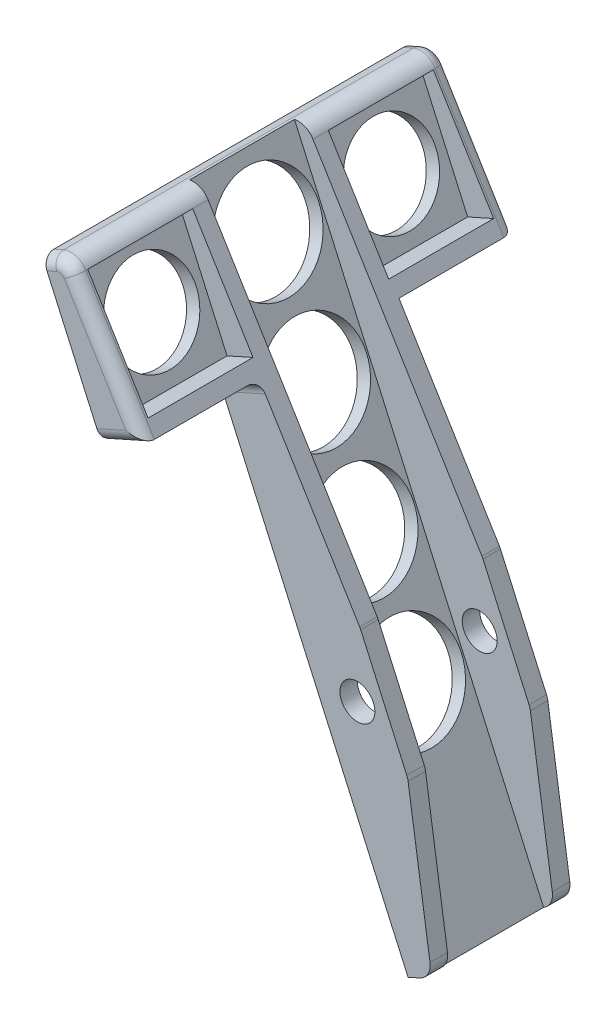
SolidWorks part; units mm, degrees
ref_plane "Plan de face" through (0, 0, 0) normal (0, 0, 1) x (1, 0, 0)
ref_plane "Plan de dessus" through (0, 0, 0) normal (0, 1, 0) x (1, 0, 0)
ref_plane "Plan de droite" through (0, 0, 0) normal (1, 0, 0) x (0, 0, -1)
sketch "Esquisse1" plane through (0, 0, -3) normal (0, 0, 1) x (1, 0, 0)
  line L2 (8.6953, -5.9096) -> (-34.1189, 89.965)
  line L3 (-34.1189, 89.965) -> (-23.1618, 94.8581)
  line L4 (-23.1618, 94.8581) -> (19.6524, -1.0166)
  line L5 (19.6524, -1.0166) -> (8.6953, -5.9096)
  circle A0 centre (0, 30.729) radius 3
  dimension "D1" = 6
  dimension "D2" = 105
  dimension "D3" = 12
  dimension "D4" = 5
  dimension "D7" = 68
extrude "Boss.-Extru.1" add sketch "Esquisse1" against normal blind 3
sketch "Esquisse3" plane through (0, 0, -6) normal (0, 0, -1) x (-1, 0, 0)
  line L0 (34.1189, 89.965) -> (-8.6953, -5.9096)
  line L1 (-8.6953, -5.9096) -> (-10.978, -4.8902)
  line L2 (-8.6953, -5.9096) -> (-19.6524, -1.0166) construction
  line L3 (-10.978, -4.8902) -> (31.8362, 90.9844)
  line L4 (23.1618, 94.8581) -> (34.1189, 89.965) construction
  line L5 (31.8362, 90.9844) -> (34.1189, 89.965)
  dimension "D1" = 2.5
extrude "Boss.-Extru.2" add sketch "Esquisse3" along normal blind 18
sketch "Esquisse4" plane through (0, 0, -24) normal (0, 0, -1) x (-1, 0, 0)
  line L4 (-19.6524, -1.0166) -> (-8.6953, -5.9096)
  line L5 (23.1618, 94.8581) -> (-19.6524, -1.0166)
  line L6 (34.1189, 89.965) -> (23.1618, 94.8581)
  line L7 (-8.6953, -5.9096) -> (34.1189, 89.965)
  line L8 (-19.6524, -1.0166) -> (-8.6953, -5.9096)
  line L9 (23.1618, 94.8581) -> (-19.6524, -1.0166)
  line L10 (34.1189, 89.965) -> (23.1618, 94.8581)
  line L11 (-8.6953, -5.9096) -> (34.1189, 89.965)
  circle A0 centre (0, 30.729) radius 3 construction
  circle A1 centre (0, 30.729) radius 3
  dimension "D1" = 0
extrude "Boss.-Extru.3" add sketch "Esquisse4" along normal blind 3
sketch "Esquisse5" plane through (0, 0, -3) normal (0, 0, 1) x (1, 0, 0)
  line L0 (19.6524, -1.0166) -> (-23.1618, 94.8581) construction
  line L1 (-8.1628, 61.2705) -> (-17.7035, 82.6351)
  arc A0 (-8.1628, 61.2705) -> (-17.7035, 82.6351) centre (-12.6754, 72.0679) ccw
sketch "Esquisse6" plane through (0, 0, -24) normal (0, 0, 1) x (1, 0, 0)
  line L1 (-17.7035, 82.6351) -> (-8.1628, 61.2705)
  line L2 (-17.7035, 82.6351) -> (-8.1628, 61.2705)
  arc A1 (-8.1628, 61.2705) -> (-17.7035, 82.6351) centre (-12.6754, 72.0679) ccw
  arc A2 (-8.1628, 61.2705) -> (-17.7035, 82.6351) centre (-12.6754, 72.0679) ccw
  dimension "D1" = 0
fillet "Congé1" radius 3 2 edges at (19.6524, -1.0166, -25.5) (19.6524, -1.0166, -4.5)
sketch "Esquisse7" plane through (5.0493, 2.2548, 0) normal (-0.9131, -0.4078, 0) x (0, 0, 1)
  line L0 (-15, 96.0584) -> (-15, 69.5886) construction
  line L1 (-45, 96.0584) -> (15, 96.0584)
  line L2 (-45, 96.0584) -> (-45, 76.0584)
  line L3 (-45, 76.0584) -> (15, 76.0584)
  line L4 (15, 96.0584) -> (15, 76.0584)
  line L5 (-27, -8.9416) -> (-27, 96.0584) construction
  line L6 (-3, 96.0584) -> (-3, -8.9416) construction
  dimension "D1" = 60
  dimension "D2" = 20
fillet "Congé2" radius 3 2 edges at (-23.1618, 94.8581, -25.5) (-23.1618, 94.8581, -4.5)
sketch "Esquisse9" plane through (0, 0, -3) normal (0, 0, 1) x (1, 0, 0)
  line L0 (0.4879, 41.8987) -> (-30.01, 91.7999)
  line L1 (18.4291, 1.7227) -> (-21.9386, 92.1188) construction
  line L2 (-25.9011, 93.6348) -> (-34.1189, 89.965) construction
  line L3 (8.643, 23.6369) -> (12.8042, -4.0747)
  line L4 (8.6953, -5.9096) -> (16.9131, -2.2398) construction
  line L5 (0, 30.729) -> (4.5655, 32.7678) construction
  line L6 (-25.9011, 93.6348) -> (-30.01, 91.7999)
  line L7 (18.4291, 1.7227) -> (8.643, 23.6369)
  line L8 (12.8042, -4.0747) -> (16.9131, -2.2398)
  line L9 (0.4879, 41.8987) -> (-21.9386, 92.1188)
  arc A0 (-21.9386, 92.1188) -> (-25.9011, 93.6348) centre (-24.6778, 90.8955) ccw construction
  arc A1 (16.9131, -2.2398) -> (18.4291, 1.7227) centre (15.6898, 0.4994) ccw construction
  arc A2 (-21.9386, 92.1188) -> (-25.9011, 93.6348) centre (-24.6778, 90.8955) ccw
  arc A3 (16.9131, -2.2398) -> (18.4291, 1.7227) centre (15.6898, 0.4994) ccw
  dimension "D1" = 20
extrude "Enlèv. mat.-Extru.2" cut sketch "Esquisse9" against normal through all
fillet "Congé3" radius 3 6 edges at (-30.01, 91.7999, -25.5) (0.4879, 41.8987, -4.5) (0.4879, 41.8987, -25.5) (8.643, 23.6369, -4.5) (8.643, 23.6369, -25.5) (12.8042, -4.0747, -25.5)
sketch "Esquisse11" plane through (0, 0, -3) normal (0, 0, 1) x (1, 0, 0)
  line L0 (-23.9251, 67.1377) -> (-16.8644, 70.2908)
  line L6 (0.3872, 42.0635) -> (-28.6348, 89.5498)
  line L7 (-32.4179, 90.7246) -> (-34.1189, 89.965)
  line L8 (-34.1189, 89.965) -> (8.6953, -5.9096)
  line L9 (8.6953, -5.9096) -> (10.7221, -5.0045)
  line L10 (12.4656, -1.8198) -> (8.7037, 23.2325)
  line L11 (8.4763, 24.0103) -> (0.5667, 41.7224)
  line L12 (-16.8644, 70.2908) -> (-28.6348, 89.5498)
  line L13 (-32.4179, 90.7246) -> (-34.1189, 89.965)
  line L14 (-34.1189, 89.965) -> (-23.9251, 67.1377)
  arc A4 (-28.6348, 89.5498) -> (-32.4179, 90.7246) centre (-31.1946, 87.9854) ccw
  arc A5 (10.7221, -5.0045) -> (12.4656, -1.8198) centre (9.4988, -2.2652) ccw
  arc A6 (8.7037, 23.2325) -> (8.4763, 24.0103) centre (5.737, 22.787) ccw
  arc A7 (0.5667, 41.7224) -> (0.3872, 42.0635) centre (-2.1726, 40.4991) ccw
  arc A8 (-28.6348, 89.5498) -> (-32.4179, 90.7246) centre (-31.1946, 87.9854) ccw
  dimension "D2" = 25
  dimension "D1" = 0
extrude "Boss.-Extru.4" add sketch "Esquisse11" along normal blind 20
sketch "Esquisse12" plane through (0, 0, -27) normal (0, 0, -1) x (-1, 0, 0)
  line L4 (34.1189, 89.965) -> (32.4179, 90.7246)
  line L5 (23.9251, 67.1377) -> (34.1189, 89.965)
  line L6 (16.8644, 70.2908) -> (23.9251, 67.1377)
  line L7 (28.6348, 89.5498) -> (16.8644, 70.2908)
  line L8 (34.1189, 89.965) -> (32.4179, 90.7246)
  line L9 (23.9251, 67.1377) -> (34.1189, 89.965)
  line L10 (16.8644, 70.2908) -> (23.9251, 67.1377)
  line L11 (28.6348, 89.5498) -> (16.8644, 70.2908)
  arc A1 (32.4179, 90.7246) -> (28.6348, 89.5498) centre (31.1946, 87.9854) ccw
  arc A2 (32.4179, 90.7246) -> (28.6348, 89.5498) centre (31.1946, 87.9854) ccw
  dimension "D1" = 0
extrude "Boss.-Extru.5" add sketch "Esquisse12" along normal blind 20
fillet "Congé4" radius 2 9 edges at (-22.7496, 79.9203, -47) (-30.3049, 90.8504, -47) (-22.7496, 79.9203, 17) (-30.3049, 90.8504, 17) (-20.3947, 68.7142, -47) (-33.2684, 90.3448, -47) (-33.2684, 90.3448, 17) (-20.3947, 68.7142, 17)
sketch "Esquisse10" plane through (5.0493, 2.2548, 0) normal (-0.9131, -0.4078, 0) x (0, 0, 1)
  line L0 (-15, 96.0584) -> (-15, 69.5886) construction
  line L1 (-15, 96.0584) -> (-15, 66.8288) construction
  line L2 (-45, 96.0584) -> (15, 96.0584) construction
  circle A0 centre (-15, 85.0404) radius 8.7511
  circle A1 centre (-15, 65.0404) radius 8.7511
  circle A2 centre (-15, 45.0404) radius 8.7511
  circle A3 centre (-15, 25.0404) radius 8.7511
  circle A4 centre (-35.585, 83.5584) radius 7.6574
  circle A5 centre (5.585, 83.5584) radius 7.6574
  dimension "D1" = 4
extrude "Enlèv. mat.-Extru.3" cut sketch "Esquisse10" against normal blind 20
sketch "Esquisse13" plane through (7.332, 3.2742, 0) normal (0.9131, 0.4078, 0) x (0, 0, -1)
  line L0 (6, 93.4432) -> (-15, 93.4432) construction
  line L1 (-14.6737, 93.4432) -> (3.3551, 93.4432)
  line L2 (-14.6737, 93.4432) -> (-14.6737, 73.7412)
  line L3 (-14.6737, 73.7412) -> (3.3551, 73.7412)
  line L4 (3.3551, 93.4432) -> (3.3551, 73.7412)
  line L5 (15, 95.99) -> (15, 76.2893) construction
  line L6 (24, 95.99) -> (6, 95.99) construction
  line L7 (26.6449, 93.4432) -> (26.6449, 73.7412)
  line L8 (44.6737, 73.7412) -> (26.6449, 73.7412)
  line L9 (44.6737, 93.4432) -> (44.6737, 73.7412)
  line L10 (44.6737, 93.4432) -> (26.6449, 93.4432)
  circle A0 centre (15, 85.0404) radius 8.7511 construction
extrude "Enlèv. mat.-Extru.4" cut sketch "Esquisse13" along normal blind 20
